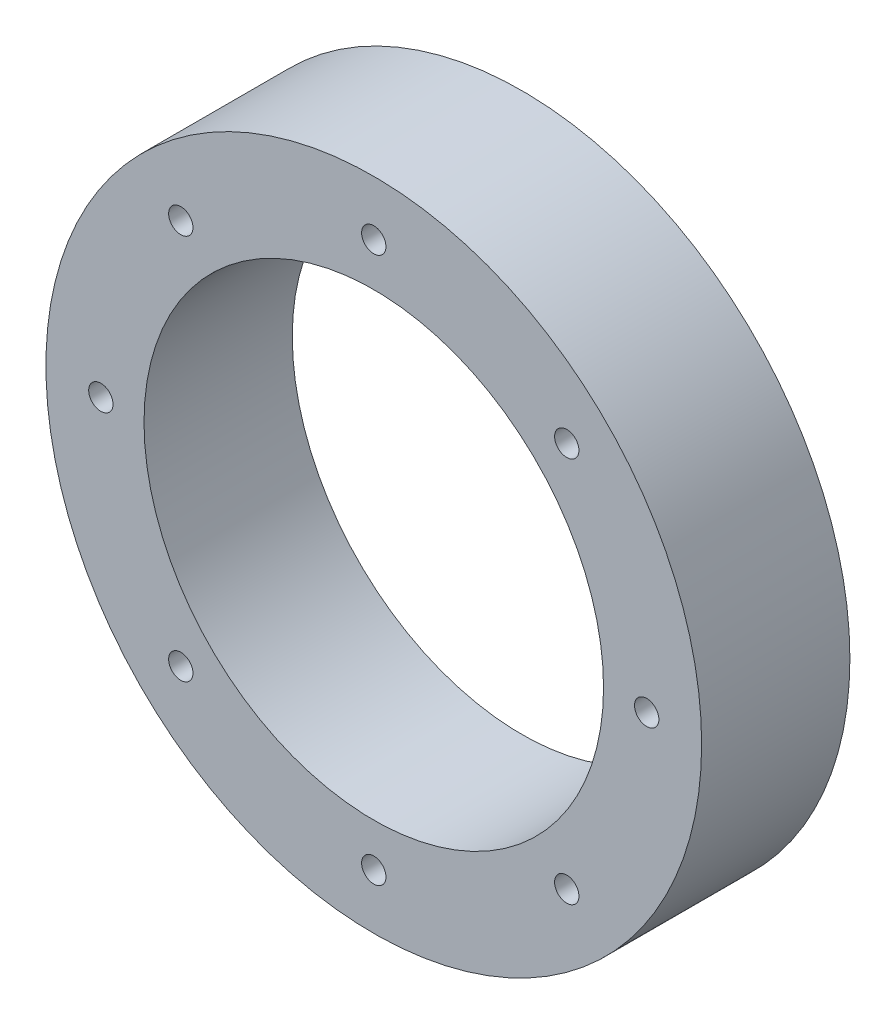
SolidWorks part; units mm, degrees
ref_plane "Front Plane" through (0, 0, 0) normal (1, 0, 0) x (0, 1, 0)
ref_plane "Top Plane" through (0, 0, 0) normal (0, 0, 1) x (0, 1, 0)
ref_plane "Right Plane" through (0, 0, 0) normal (0, 1, 0) x (-1, 0, 0)
sketch "Sketch1" plane through (0, 0, 0) normal (0, 0, 1) x (0, 1, 0)
  line L0 (0, 0) -> (37, 0) construction
  circle A0 centre (0, 0) radius 31.15
  circle A1 centre (0, 0) radius 44.45
  circle A2 centre (37, 0) radius 1.65
  circle A3 centre (26.163, -26.163) radius 1.65
  circle A4 centre (0, -37) radius 1.65
  circle A5 centre (-26.163, -26.163) radius 1.65
  circle A6 centre (-37, 0) radius 1.65
  circle A7 centre (-26.163, 26.163) radius 1.65
  circle A8 centre (0, 37) radius 1.65
  circle A9 centre (26.163, 26.163) radius 1.65
  dimension "D1" = 62.3
  dimension "D2" = 88.9
  dimension "D3" = 3.3
  dimension "D4" = 37
  dimension "D5" = 8
extrude "Boss-Extrude1" add sketch "Sketch1" along normal mid plane 20.1
